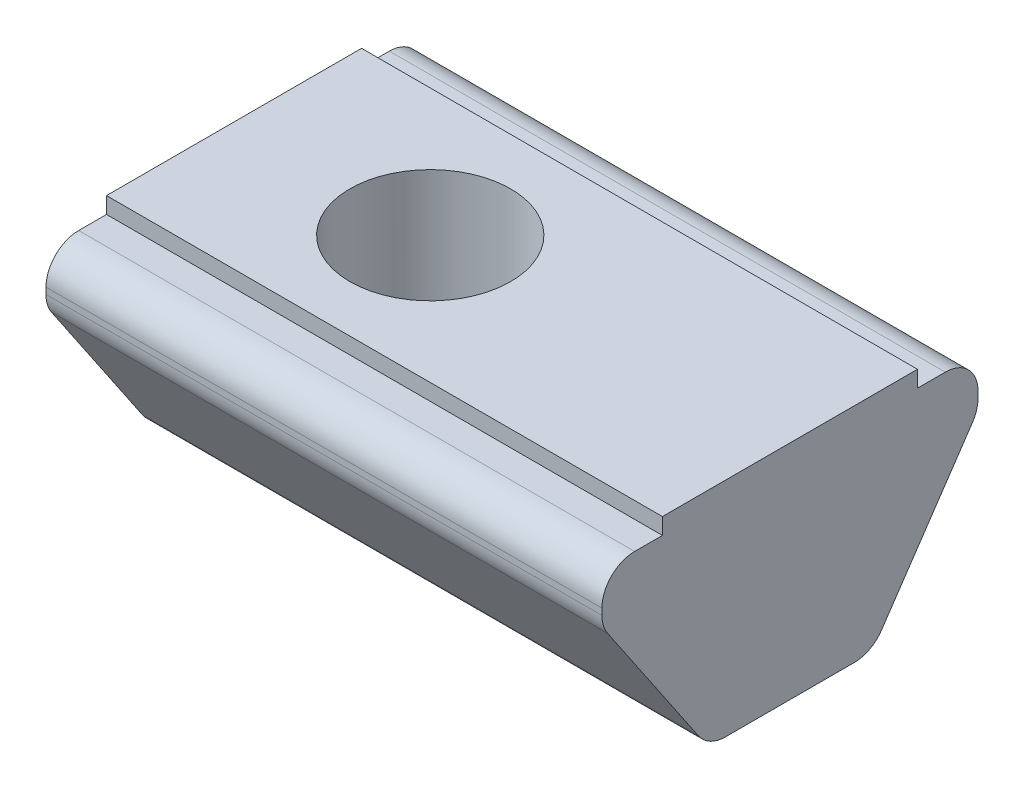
SolidWorks part; units mm, degrees
ref_plane "Front Plane" through (0, 0, 0) normal (0, 0, 1) x (1, 0, 0)
ref_plane "Top Plane" through (0, 0, 0) normal (0, 1, 0) x (1, 0, 0)
ref_plane "Right Plane" through (0, 0, 0) normal (1, 0, 0) x (0, 0, -1)
ref_plane "Plane1" through (-6, 0, 0) normal (1, 0, 0) x (0, 0, -1)
ref_plane "Plane2" through (7.5, 0, 0) normal (1, 0, 0) x (0, 0, -1)
ref_plane "Plane3" through (-3.1, 0, 0) normal (1, 0, 0) x (0, 0, -1)
sketch "Axis_Line_X" plane through (0, 0, 0) normal (0, 1, 0) x (1, 0, 0)
  line L0 (0, 0) -> (50, 0)
  dimension "FIX_2" = 50
sketch "Axis_Line_Z" plane through (0, 0, 0) normal (0, 1, 0) x (1, 0, 0)
  line L0 (0, 0) -> (0, -50)
  dimension "FIX_3" = 50
sketch "Sketch1" plane through (-6, 0, 0) normal (1, 0, 0) x (0, 0, -1)
  line L0 (3.9, 0) -> (-3.9, 0)
  line L1 (-3.9, 0) -> (-3.9, -0.5)
  line L2 (-3.9, -0.5) -> (-5.75, -0.5)
  line L3 (-5.75, -0.5) -> (-5.75, -2)
  line L4 (-5.75, -2) -> (-2.5, -6.8)
  line L5 (-2.5, -6.8) -> (2.5, -6.8)
  line L6 (2.5, -6.8) -> (5.75, -2)
  line L7 (5.75, -2) -> (5.75, -0.5)
  line L8 (5.75, -0.5) -> (3.9, -0.5)
  line L9 (3.9, -0.5) -> (3.9, 0)
  line L10 (0, 0) -> (0, -6.8) construction
  point P15 (-5.75, -2)
  point P18 (-2.5, -6.8)
  point P24 (5.75, -2)
  dimension "FIX_8" = 6.3
  dimension "FIX_9" = 1.5
  dimension "FIX_4" = 11.5
  dimension "FIX_6" = 7.8
  dimension "FIX_5" = 6.8
  dimension "FIX_7" = 5
extrude "Boss-Extrude1" add sketch "Sketch1" along normal blind 17
fillet "Fillet1" radius 1 6 edges at (2.5, -0.5, 5.75) (2.5, -2, 5.75) (2.5, -6.8, 2.5) (2.5, -6.8, -2.5) (2.5, -2, -5.75) (2.5, -0.5, -5.75)
sketch "Sketch2" plane through (7.5, 0, 0) normal (1, 0, 0) x (0, 0, -1)
  line L0 (0, 1.6655) -> (0, -9.505) construction
  line L2 (0, -6.6) -> (2.35, -6.6)
  line L3 (0, -6.6) -> (0, -6.8)
  line L4 (0, -6.8) -> (2.35, -6.8)
  line L5 (2.35, -6.6) -> (2.35, -6.8)
  dimension "FIX_13" = 0.2
  dimension "FIX_12" = 2.35
  dimension "FIX_11" = 6.8
revolve "Cut-Revolve1" cut sketch "Sketch2" angle 360 about L0
sketch "Sketch3" plane through (7.5, 0, 0) normal (1, 0, 0) x (0, 0, -1)
  line L0 (0, 0) -> (0, -7.8) construction
  line L1 (1.99, -6.6) -> (0, -6.6) construction
  line L2 (1.99, -7.8) -> (0, -7.8) construction
  line L3 (1.99, -6.6) -> (0, -6.6)
  line L4 (0, -6.6) -> (0, -7.8)
  arc A0 (0, -7.8) -> (1.99, -6.6) centre (0, -5.55) ccw
  dimension "FIX_17" = 4.5
  dimension "FIX_15" = 7.8
  dimension "FIX_16" = 6.6
revolve "Revolve1" add sketch "Sketch3" angle 360 about L0
hole_wizard "Tapped Hole1" positions "Sketch5" profile "Sketch4" tap size "M6x1.0" standard "JIS"
sketch "Sketch5" plane through (0, 0, 0) normal (0, 1, 0) x (1, 0, 0)
  point P0 (0, 0)
sketch "Sketch4" plane through (0, 0, 0) normal (1, 0, 0) x (0, 0, 1)
  line L0 (0, 0) -> (0, 7.8)
  line L1 (0, 7.8) -> (2.4585, 7.8)
  line L2 (2.4585, 7.8) -> (2.4585, 0)
  line L5 (2.4585, 0) -> (0, 0)
  line L11 (0, 0) -> (0, 7.8) construction
  dimension "Thru Tap Drill Dia." = 4.917
  dimension "Thru Tap Drill Depth" = 7.8
sketch "Sketch6" [suppressed] plane through (-3.1, 0, 0) normal (1, 0, 0) x (0, 0, -1)
  line L0 (4.9, -0.4) -> (4.9, -0.5)
  line L1 (4.9, -0.5) -> (5, -0.5)
  line L2 (4.9, -0.4) -> (4.9, -0.5) construction
  arc A0 (5, -0.5) -> (4.9, -0.4) centre (4.9, -0.5) ccw
  dimension "FIX_21" = 0.1
  dimension "FIX_19" = 4.9
  dimension "FIX_20" = 0.5
revolve "Revolve2" [suppressed] add sketch "Sketch6" angle 360 about L2
pattern_linear "LPattern1" [suppressed]
equation "\"SHNTP6\" = if ( \"L1\" = 6 , \"suppressed\" , \"unsuppressed\" )"
